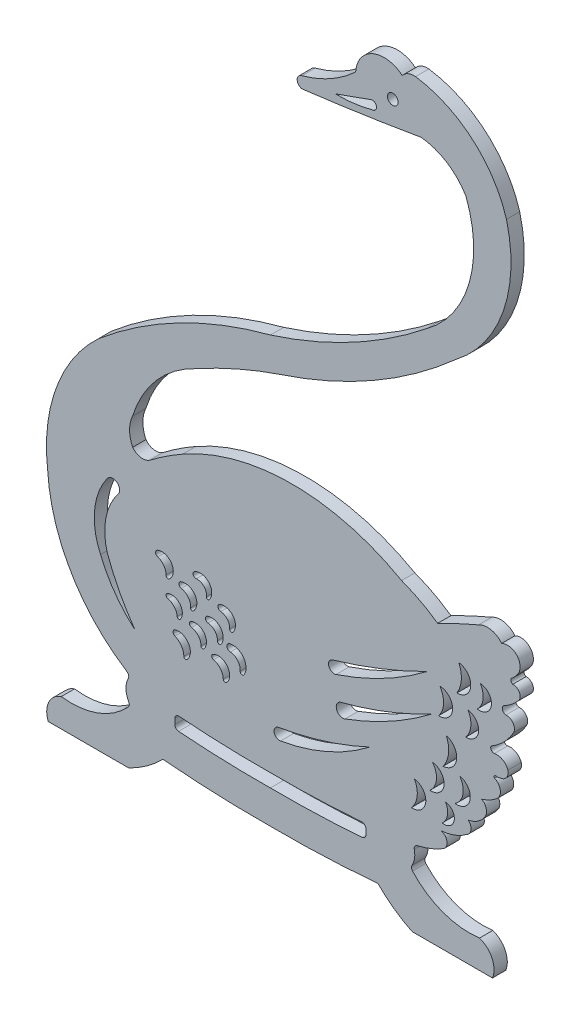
SolidWorks part; units mm, degrees
ref_plane "Спереди" through (0, 0, 0) normal (0, 0, 1) x (1, 0, 0)
ref_plane "Сверху" through (0, 0, 0) normal (0, 1, 0) x (1, 0, 0)
ref_plane "Справа" through (0, 0, 0) normal (1, 0, 0) x (0, 0, -1)
imported_body "Импортированный1"
sketch "Эскиз2" plane through (0, 0, 0) normal (0, 0, -1) x (-1, 0, 0)
  line L3 (868.5282, 469.7115) -> (538.7238, 469.7115)
  line L4 (401.7946, 19.7115) -> (522.9904, 19.7115)
  line L5 (949.7016, 19.7115) -> (1070.8973, 19.7115)
  line L6 (868.5282, 469.7115) -> (538.7238, 469.7115)
  line L7 (401.7946, 19.7115) -> (522.9904, 19.7115)
  line L8 (949.7016, 19.7115) -> (1070.8973, 19.7115)
  arc A57 (688.8469, 1035.9946) -> (688.8469, 1053.0676) centre (687.2707, 1044.5311) ccw
  arc A58 (607.9212, 1098.417) -> (688.8469, 1053.0676) centre (740.9753, 1240.9709) ccw
  arc A59 (607.9212, 1098.417) -> (537.6825, 1129.021) centre (565.0001, 1095.8133) ccw
  arc A60 (537.6825, 1129.021) -> (517.6288, 1137.6043) centre (519.6877, 1114.6966) ccw
  arc A61 (517.6288, 1137.6043) -> (380.7487, 1019.8224) centre (541.7215, 971.1765) ccw
  arc A62 (380.7487, 1019.8224) -> (456.8229, 799.0795) centre (584.4304, 966.5368) ccw
  arc A63 (456.8229, 799.0795) -> (719.8602, 647.7491) centre (951.0519, 1353.8648) ccw
  arc A64 (848.3446, 591.2479) -> (719.8602, 647.7491) centre (462.2939, -112.2987) ccw
  arc A65 (943.7801, 481.9923) -> (848.3446, 591.2479) centre (771.992, 428.244) ccw
  arc A66 (943.7801, 440.9891) -> (943.7801, 481.9923) centre (900.4631, 461.4907) ccw
  arc A67 (918.5018, 436.6678) -> (943.7801, 440.9891) centre (928.7783, 452.6488) ccw
  arc A68 (918.5018, 436.6678) -> (868.5282, 469.7115) centre (652.2659, 88.3366) ccw
  arc A69 (538.7238, 469.7115) -> (484.3368, 441.1015) centre (619.0578, 250.9983) ccw
  arc A70 (484.3368, 441.1015) -> (422.9922, 469.7115) centre (17.8065, -479.148) ccw
  arc A71 (422.9922, 469.7115) -> (388.0052, 462.9934) centre (409.3249, 446.4262) ccw
  arc A72 (388.0052, 462.9934) -> (364.5858, 433.9937) centre (379.1684, 446.1735) ccw
  arc A73 (364.5858, 433.9937) -> (373.3228, 424.8523) centre (396.3844, 455.6397) ccw
  arc A74 (371.3054, 418.0965) -> (373.3228, 424.8523) centre (369.8094, 422.2224) ccw
  arc A75 (371.3054, 418.0965) -> (364.5858, 399.1712) centre (370.4747, 407.7359) ccw
  arc A76 (364.5858, 399.1712) -> (383.6651, 384.2135) centre (413.5253, 441.9488) ccw
  arc A77 (381.5911, 372.8991) -> (383.6651, 384.2135) centre (380.9471, 378.8645) ccw
  arc A78 (381.5911, 372.8991) -> (370.0347, 355.5399) centre (380.757, 360.9281) ccw
  arc A79 (370.0347, 355.5399) -> (403.8072, 321.3501) centre (449.0444, 399.81) ccw
  arc A80 (399.0201, 313.9207) -> (403.8072, 321.3501) centre (399.4473, 318.9024) ccw
  arc A81 (399.0201, 313.9207) -> (378.4043, 302.6039) centre (395.2702, 296.3156) ccw
  arc A82 (378.4043, 302.6039) -> (388.7243, 286.6638) centre (391.0184, 299.4597) ccw
  arc A83 (388.7243, 286.6638) -> (397.4244, 285.8687) centre (395.1293, 308.7539) ccw
  arc A84 (398.5381, 281.9715) -> (397.4244, 285.8687) centre (397.0366, 283.6502) ccw
  arc A85 (398.5381, 281.9715) -> (396.3989, 255.9783) centre (404.8559, 268.3669) ccw
  arc A86 (396.3989, 255.9783) -> (418.0373, 244.8271) centre (437.3612, 308.8941) ccw
  arc A87 (418.0373, 244.8271) -> (412.1859, 225.8588) centre (425.4569, 232.1516) ccw
  arc A88 (412.1859, 225.8588) -> (438.4016, 207.5553) centre (444.3958, 244.0665) ccw
  arc A89 (438.4016, 207.5553) -> (440.6745, 187.5726) centre (446.0444, 198.304) ccw
  arc A90 (440.6745, 187.5726) -> (478.9066, 173.1064) centre (484.745, 246.2905) ccw
  arc A91 (478.9066, 173.1064) -> (476.6802, 150.9026) centre (482.1883, 161.5638) ccw
  arc A92 (476.6802, 150.9026) -> (515.0092, 135.7547) centre (543.7388, 264.5152) ccw
  arc A93 (519.5611, 128.6035) -> (515.0092, 135.7547) centre (513.7025, 129.8987) ccw
  arc A94 (519.5611, 128.6035) -> (523.0272, 105.9882) centre (550.4773, 121.7686) ccw
  arc A95 (522.2621, 98.9584) -> (523.0272, 105.9882) centre (517.8255, 102.9978) ccw
  arc A96 (421.3182, 62.049) -> (522.2621, 98.9584) centre (436.4876, 177.0528) ccw
  arc A97 (421.3182, 62.049) -> (401.7946, 19.7115) centre (431.4641, 31.7) ccw
  arc A98 (522.9904, 19.7115) -> (574.4358, 56.8142) centre (441.129, 187.4353) ccw
  arc A99 (574.4358, 56.8142) -> (736.346, 50.3505) centre (720.9793, 1696.5312) ccw
  arc A100 (736.346, 50.3505) -> (898.2562, 56.8142) centre (751.7127, 1696.5312) ccw
  arc A101 (898.2562, 56.8142) -> (949.7016, 19.7115) centre (1031.563, 187.4353) ccw
  arc A102 (1070.8973, 19.7115) -> (1051.3738, 62.049) centre (1041.2279, 31.7) ccw
  arc A103 (950.4298, 98.9584) -> (1051.3738, 62.049) centre (1036.2044, 177.0528) ccw
  arc A104 (949.6647, 105.9882) -> (950.4298, 98.9584) centre (954.8664, 102.9978) ccw
  arc A105 (949.6647, 105.9882) -> (950.3117, 136.366) centre (922.2147, 121.7686) ccw
  arc A106 (952.4117, 144.1922) -> (950.3117, 136.366) centre (955.636, 139.1322) ccw
  arc A107 (952.4117, 144.1922) -> (1071.7649, 347.0866) centre (813.231, 362.6178) ccw
  arc A108 (1071.7649, 347.0866) -> (995.3907, 556.8052) centre (828.6364, 377.3114) ccw
  arc A109 (995.3907, 556.8052) -> (736.346, 691.1896) centre (568.8211, 51.3974) ccw
  arc A110 (500.679, 817.3958) -> (736.346, 691.1896) centre (958.7548, 1389.6331) ccw
  arc A111 (441.9184, 1019.8224) -> (500.679, 817.3958) centre (603.0521, 956.8545) ccw
  arc A112 (509.1798, 1062.5484) -> (441.9184, 1019.8224) centre (518.2213, 974.0089) ccw
  arc A113 (509.1798, 1062.5484) -> (688.8469, 1035.9946) centre (1152.0143, 4790.9526) ccw
  arc A114 (688.8469, 1035.9946) -> (688.8469, 1053.0676) centre (687.2707, 1044.5311) ccw
  arc A115 (607.9212, 1098.417) -> (688.8469, 1053.0676) centre (740.9753, 1240.9709) ccw
  arc A116 (607.9212, 1098.417) -> (537.6825, 1129.021) centre (565.0001, 1095.8133) ccw
  arc A117 (537.6825, 1129.021) -> (517.6288, 1137.6043) centre (519.6877, 1114.6966) ccw
  arc A118 (517.6288, 1137.6043) -> (380.7487, 1019.8224) centre (541.7215, 971.1765) ccw
  arc A119 (380.7487, 1019.8224) -> (456.8229, 799.0795) centre (584.4304, 966.5368) ccw
  arc A120 (456.8229, 799.0795) -> (719.8602, 647.7491) centre (951.0519, 1353.8648) ccw
  arc A121 (848.3446, 591.2479) -> (719.8602, 647.7491) centre (462.2939, -112.2987) ccw
  arc A122 (943.7801, 481.9923) -> (848.3446, 591.2479) centre (771.992, 428.244) ccw
  arc A123 (943.7801, 440.9891) -> (943.7801, 481.9923) centre (900.4631, 461.4907) ccw
  arc A124 (918.5018, 436.6678) -> (943.7801, 440.9891) centre (928.7783, 452.6488) ccw
  arc A125 (918.5018, 436.6678) -> (868.5282, 469.7115) centre (652.2659, 88.3366) ccw
  arc A126 (538.7238, 469.7115) -> (484.3368, 441.1015) centre (619.0578, 250.9983) ccw
  arc A127 (484.3368, 441.1015) -> (422.9922, 469.7115) centre (17.8065, -479.148) ccw
  arc A128 (422.9922, 469.7115) -> (388.0052, 462.9934) centre (409.3249, 446.4262) ccw
  arc A129 (388.0052, 462.9934) -> (364.5858, 433.9937) centre (379.1684, 446.1735) ccw
  arc A130 (364.5858, 433.9937) -> (373.3228, 424.8523) centre (396.3844, 455.6397) ccw
  arc A131 (371.3054, 418.0965) -> (373.3228, 424.8523) centre (369.8094, 422.2224) ccw
  arc A132 (371.3054, 418.0965) -> (364.5858, 399.1712) centre (370.4747, 407.7359) ccw
  arc A133 (364.5858, 399.1712) -> (383.6651, 384.2135) centre (413.5253, 441.9488) ccw
  arc A134 (381.5911, 372.8991) -> (383.6651, 384.2135) centre (380.9471, 378.8645) ccw
  arc A135 (381.5911, 372.8991) -> (370.0347, 355.5399) centre (380.757, 360.9281) ccw
  arc A136 (370.0347, 355.5399) -> (403.8072, 321.3501) centre (449.0444, 399.81) ccw
  arc A137 (399.0201, 313.9207) -> (403.8072, 321.3501) centre (399.4473, 318.9024) ccw
  arc A138 (399.0201, 313.9207) -> (378.4043, 302.6039) centre (395.2702, 296.3156) ccw
  arc A139 (378.4043, 302.6039) -> (388.7243, 286.6638) centre (391.0184, 299.4597) ccw
  arc A140 (388.7243, 286.6638) -> (397.4244, 285.8687) centre (395.1293, 308.7539) ccw
  arc A141 (398.5381, 281.9715) -> (397.4244, 285.8687) centre (397.0366, 283.6502) ccw
  arc A142 (398.5381, 281.9715) -> (396.3989, 255.9783) centre (404.8559, 268.3669) ccw
  arc A143 (396.3989, 255.9783) -> (418.0373, 244.8271) centre (437.3612, 308.8941) ccw
  arc A144 (418.0373, 244.8271) -> (412.1859, 225.8588) centre (425.4569, 232.1516) ccw
  arc A145 (412.1859, 225.8588) -> (438.4016, 207.5553) centre (444.3958, 244.0665) ccw
  arc A146 (438.4016, 207.5553) -> (440.6745, 187.5726) centre (446.0444, 198.304) ccw
  arc A147 (440.6745, 187.5726) -> (478.9066, 173.1064) centre (484.745, 246.2905) ccw
  arc A148 (478.9066, 173.1064) -> (476.6802, 150.9026) centre (482.1883, 161.5638) ccw
  arc A149 (476.6802, 150.9026) -> (515.0092, 135.7547) centre (543.7388, 264.5152) ccw
  arc A150 (519.5611, 128.6035) -> (515.0092, 135.7547) centre (513.7025, 129.8987) ccw
  arc A151 (519.5611, 128.6035) -> (523.0272, 105.9882) centre (550.4773, 121.7686) ccw
  arc A152 (522.2621, 98.9584) -> (523.0272, 105.9882) centre (517.8255, 102.9978) ccw
  arc A153 (421.3182, 62.049) -> (522.2621, 98.9584) centre (436.4876, 177.0528) ccw
  arc A154 (421.3182, 62.049) -> (401.7946, 19.7115) centre (431.4641, 31.7) ccw
  arc A155 (522.9904, 19.7115) -> (574.4358, 56.8142) centre (441.129, 187.4353) ccw
  arc A156 (574.4358, 56.8142) -> (736.346, 50.3505) centre (720.9793, 1696.5312) ccw
  arc A157 (736.346, 50.3505) -> (898.2562, 56.8142) centre (751.7127, 1696.5312) ccw
  arc A158 (898.2562, 56.8142) -> (949.7016, 19.7115) centre (1031.563, 187.4353) ccw
  arc A159 (1070.8973, 19.7115) -> (1051.3738, 62.049) centre (1041.2279, 31.7) ccw
  arc A160 (950.4298, 98.9584) -> (1051.3738, 62.049) centre (1036.2044, 177.0528) ccw
  arc A161 (949.6647, 105.9882) -> (950.4298, 98.9584) centre (954.8664, 102.9978) ccw
  arc A162 (949.6647, 105.9882) -> (950.3117, 136.366) centre (922.2147, 121.7686) ccw
  arc A163 (952.4117, 144.1922) -> (950.3117, 136.366) centre (955.636, 139.1322) ccw
  arc A164 (952.4117, 144.1922) -> (1071.7649, 347.0866) centre (813.231, 362.6178) ccw
  arc A165 (1071.7649, 347.0866) -> (995.3907, 556.8052) centre (828.6364, 377.3114) ccw
  arc A166 (995.3907, 556.8052) -> (736.346, 691.1896) centre (568.8211, 51.3974) ccw
  arc A167 (500.679, 817.3958) -> (736.346, 691.1896) centre (958.7548, 1389.6331) ccw
  arc A168 (441.9184, 1019.8224) -> (500.679, 817.3958) centre (603.0521, 956.8545) ccw
  arc A169 (509.1798, 1062.5484) -> (441.9184, 1019.8224) centre (518.2213, 974.0089) ccw
  arc A170 (509.1798, 1062.5484) -> (688.8469, 1035.9946) centre (1152.0143, 4790.9526) ccw
  dimension "D1" = 0
extrude "Бобышка-Вытянуть1" add sketch "Эскиз2" along normal blind 10
sketch "Эскиз3" plane through (0, 0, 0) normal (0, 0, 1) x (1, 0, 0)
  line L2 (-592.4581, 111.0344) -> (-592.4581, 119.0272)
  line L3 (-880.2338, 119.0272) -> (-880.2338, 111.0344)
  line L4 (-592.4581, 111.0344) -> (-592.4581, 119.0272)
  line L5 (-880.2338, 119.0272) -> (-880.2338, 111.0344)
  arc A0 (-477.5905, 184.1168) -> (-472.5039, 214.1392) centre (-474.4703, 199.0303) ccw construction
  arc A1 (-477.5905, 184.1168) -> (-472.5039, 214.1392) centre (-492.9762, 202.1657) ccw construction
  arc A2 (-458.1955, 219.2578) -> (-451.2096, 258.6271) centre (-455.2554, 239.0406) ccw construction
  arc A3 (-458.1955, 219.2578) -> (-451.2096, 258.6271) centre (-473.3308, 242.2479) ccw construction
  arc A4 (-496.0892, 217.5153) -> (-492.1133, 255.9783) centre (-494.0507, 236.7416) ccw construction
  arc A5 (-496.0892, 217.5153) -> (-492.1133, 255.9783) centre (-513.6282, 238.7653) ccw construction
  arc A6 (-523.9435, 180.8733) -> (-519.3103, 220.586) centre (-522.222, 200.799) ccw construction
  arc A7 (-523.9435, 180.8733) -> (-519.3103, 220.586) centre (-549.3516, 203.9642) ccw construction
  arc A8 (-597.9941, 105.0524) -> (-592.4581, 111.0344) centre (-598.4581, 111.0344) ccw
  arc A9 (-592.4581, 119.0272) -> (-598.9252, 125.009) centre (-598.4581, 119.0272) ccw
  arc A10 (-736.346, 120.2942) -> (-598.9252, 125.009) centre (-721.6327, 1696.4778) ccw
  arc A11 (-873.7668, 125.009) -> (-736.346, 120.2942) centre (-751.0593, 1696.4778) ccw
  arc A12 (-873.7668, 125.009) -> (-880.2338, 119.0272) centre (-874.2338, 119.0272) ccw
  arc A13 (-880.2338, 111.0344) -> (-874.6979, 105.0524) centre (-874.2338, 111.0344) ccw
  arc A14 (-874.6979, 105.0524) -> (-736.346, 100.341) centre (-751.246, 1696.5238) ccw
  arc A15 (-736.346, 100.341) -> (-597.9941, 105.0524) centre (-721.446, 1696.5238) ccw
  arc A16 (-597.9941, 105.0524) -> (-592.4581, 111.0344) centre (-598.4581, 111.0344) ccw
  arc A17 (-592.4581, 119.0272) -> (-598.9252, 125.009) centre (-598.4581, 119.0272) ccw
  arc A18 (-736.346, 120.2942) -> (-598.9252, 125.009) centre (-721.6327, 1696.4778) ccw
  arc A19 (-873.7668, 125.009) -> (-736.346, 120.2942) centre (-751.0593, 1696.4778) ccw
  arc A20 (-873.7668, 125.009) -> (-880.2338, 119.0272) centre (-874.2338, 119.0272) ccw
  arc A21 (-880.2338, 111.0344) -> (-874.6979, 105.0524) centre (-874.2338, 111.0344) ccw
  arc A22 (-874.6979, 105.0524) -> (-736.346, 100.341) centre (-751.246, 1696.5238) ccw
  arc A23 (-736.346, 100.341) -> (-597.9941, 105.0524) centre (-721.446, 1696.5238) ccw
  arc A24 (-476.3308, 258.6271) -> (-471.4266, 301.351) centre (-477.5097, 280.4058) ccw construction
  arc A25 (-476.3308, 258.6271) -> (-471.4266, 301.351) centre (-509.5697, 284.0859) ccw construction
  arc A26 (-441.8768, 313.9207) -> (-438.378, 350.7936) centre (-441.1818, 332.4572) ccw construction
  arc A27 (-441.8768, 313.9207) -> (-438.378, 350.7936) centre (-467.1669, 334.9228) ccw construction
  arc A28 (-424.6824, 359.1917) -> (-420.1448, 394.8384) centre (-421.336, 376.8779) ccw construction
  arc A29 (-424.6824, 359.1917) -> (-420.1448, 394.8384) centre (-444.1827, 379.7861) ccw construction
  arc A30 (-455.3824, 364.6592) -> (-452.3767, 405.8028) centre (-455.1888, 385.3266) ccw construction
  arc A31 (-455.3824, 364.6592) -> (-452.3767, 405.8028) centre (-492.5757, 388.0578) ccw construction
  arc A32 (-482.9082, 321.3501) -> (-481.1588, 360.9281) centre (-481.6856, 341.1237) ccw construction
  arc A33 (-482.9082, 321.3501) -> (-481.1588, 360.9281) centre (-508.4558, 342.307) ccw construction
  arc A34 (-623.9132, 246.5173) -> (-492.6473, 318.6729) centre (-797.3924, 717.5895) ccw construction
  arc A35 (-630.3339, 265.0895) -> (-492.6473, 318.6729) centre (-790.1828, 879.5234) ccw construction
  arc A36 (-630.3339, 265.0895) -> (-623.9132, 246.5173) centre (-627.3093, 255.7392) ccw construction
  arc A37 (-637.432, 297.8044) -> (-500.0717, 370.3439) centre (-787.5815, 748.4485) ccw construction
  arc A38 (-643.2502, 314.0066) -> (-500.0717, 370.3439) centre (-880.1458, 1126.1742) ccw construction
  arc A39 (-643.2502, 314.0066) -> (-637.432, 297.8044) centre (-640.1536, 305.9729) ccw construction
  arc A40 (-721.0746, 169.224) -> (-586.6425, 228.5446) centre (-773.7805, 470.6507) ccw construction
  arc A41 (-724.5954, 185.3932) -> (-586.6425, 228.5446) centre (-815.3819, 717.7235) ccw construction
  arc A42 (-724.5954, 185.3932) -> (-721.0746, 169.224) centre (-722.501, 177.3813) ccw construction
  arc A43 (-776.1585, 227.8902) -> (-797.7578, 257.8293) centre (-792.8378, 238.6179) ccw construction
  arc A44 (-797.7578, 257.8293) -> (-796.7761, 247.4894) centre (-796.4536, 252.7366) ccw construction
  arc A45 (-781.8418, 229.8817) -> (-796.7761, 247.4894) centre (-797.7578, 231.5196) ccw construction
  arc A46 (-781.8418, 229.8817) -> (-776.1585, 227.8902) centre (-778.7622, 229.5649) ccw construction
  arc A47 (-802.3544, 204.8909) -> (-822.8115, 231.5196) centre (-814.697, 216.5812) ccw construction
  arc A48 (-822.8115, 231.5196) -> (-821.9153, 224.7626) centre (-821.0695, 228.3127) ccw construction
  arc A49 (-807.3255, 206.7939) -> (-821.9153, 224.7626) centre (-826.3186, 206.2799) ccw construction
  arc A50 (-807.3255, 206.7939) -> (-802.3544, 204.8909) centre (-804.4459, 206.8719) ccw construction
  arc A51 (-836.5946, 231.5196) -> (-856.0766, 257.8293) centre (-849.4021, 242.4038) ccw construction
  arc A52 (-856.0766, 257.8293) -> (-855.1364, 250.3431) centre (-854.5162, 254.2231) ccw construction
  arc A53 (-840.8251, 233.1342) -> (-855.1364, 250.3431) centre (-857.8199, 233.5562) ccw construction
  arc A54 (-840.8251, 233.1342) -> (-836.5946, 231.5196) centre (-838.4245, 233.0746) ccw construction
  arc A55 (-810.7489, 250.554) -> (-831.5754, 276.7456) centre (-824.8011, 260.7562) ccw construction
  arc A56 (-831.5754, 276.7456) -> (-830.2692, 268.551) centre (-829.908, 272.8099) ccw construction
  arc A57 (-816.1316, 252.4391) -> (-830.2692, 268.551) centre (-831.5754, 253.1462) ccw construction
  arc A58 (-816.1316, 252.4391) -> (-810.7489, 250.554) centre (-813.1578, 252.3029) ccw construction
  arc A59 (-792.8139, 275.2398) -> (-812.5219, 301.6969) centre (-805.9651, 286.0122) ccw construction
  arc A60 (-812.5219, 301.6969) -> (-811.1852, 293.0494) centre (-810.7836, 297.5385) ccw construction
  arc A61 (-797.555, 277.1135) -> (-811.1852, 293.0494) centre (-812.5219, 278.1091) ccw construction
  arc A62 (-797.555, 277.1135) -> (-792.8139, 275.2398) centre (-794.8844, 276.9358) ccw construction
  arc A63 (-872.1065, 252.4479) -> (-891.2805, 276.7456) centre (-884.982, 262.0017) ccw construction
  arc A64 (-891.2805, 276.7456) -> (-890.6768, 269.9925) centre (-889.88, 273.4673) ccw construction
  arc A65 (-876.7501, 253.7923) -> (-890.6768, 269.9925) centre (-894.6999, 252.4479) ccw construction
  arc A66 (-876.7501, 253.7923) -> (-872.1065, 252.4479) centre (-874.1779, 253.9849) ccw construction
  arc A67 (-852.5926, 273.0351) -> (-871.677, 301.6969) centre (-864.528, 285.7725) ccw construction
  arc A68 (-871.677, 301.6969) -> (-870.6321, 293.5056) centre (-869.9096, 297.7601) ccw construction
  arc A69 (-856.5673, 275.0054) -> (-870.6321, 293.5056) centre (-873.478, 276.7456) ccw construction
  arc A70 (-856.5673, 275.0054) -> (-852.5926, 273.0351) centre (-854.2118, 274.763) ccw construction
  arc A71 (-828.6405, 299.7337) -> (-850.6405, 325.4198) centre (-841.7978, 310.7291) ccw construction
  arc A72 (-850.6405, 325.4198) -> (-847.9704, 317.4421) centre (-848.4183, 321.7279) ccw construction
  arc A73 (-832.6577, 301.5251) -> (-847.9704, 317.4421) centre (-846.5152, 303.5179) ccw construction
  arc A74 (-832.6577, 301.5251) -> (-828.6405, 299.7337) centre (-830.3948, 301.1997) ccw construction
  arc A75 (-888.4071, 297.053) -> (-906.4358, 325.4198) centre (-899.5852, 309.8612) ccw construction
  arc A76 (-906.4358, 325.4198) -> (-905.9846, 316.8801) centre (-904.5934, 321.2354) ccw construction
  arc A77 (-893.4647, 299.4075) -> (-905.9846, 316.8801) centre (-911.4617, 299.7337) ccw construction
  arc A78 (-893.4647, 299.4075) -> (-888.4071, 297.053) centre (-890.4136, 299.3522) ccw construction
  arc A79 (-862.2123, 204.8505) -> (-879.3725, 235.078) centre (-874.8672, 217.6509) ccw construction
  arc A80 (-879.3725, 235.078) -> (-879.9772, 226.5037) centre (-878.238, 230.6895) ccw construction
  arc A81 (-866.6981, 206.7108) -> (-879.9772, 226.5037) centre (-888.2448, 206.606) ccw construction
  arc A82 (-866.6981, 206.7108) -> (-862.2123, 204.8505) centre (-864.0641, 206.7236) ccw construction
  arc A83 (-992.1136, 276.882) -> (-940.1502, 204.4855) centre (-816.9171, 347.7845) ccw construction
  arc A84 (-982.0148, 284.2433) -> (-940.1502, 204.4855) centre (-668.2313, 398.0808) ccw construction
  arc A85 (-965.6462, 368.9995) -> (-982.0148, 284.2433) centre (-891.8403, 310.7871) ccw construction
  arc A86 (-965.6462, 368.9995) -> (-981.9263, 381.2954) centre (-973.6574, 375.3181) ccw construction
  arc A87 (-981.9263, 381.2954) -> (-992.1136, 276.882) centre (-897.6418, 320.3684) ccw construction
  arc A88 (-638.7661, 1054.6399) -> (-580.3301, 1062.23) centre (-635.527, 1258.4469) ccw construction
  arc A89 (-580.3301, 1062.23) -> (-584.8507, 1073.9657) centre (-582.6845, 1068.0616) ccw construction
  arc A90 (-638.7661, 1054.6399) -> (-584.8507, 1073.9657) centre (-1907.4817, 4678.9966) ccw construction
  circle A91 centre (-551.972, 1090.8568) radius 8 construction
  arc A92 (-477.5905, 184.1168) -> (-472.5039, 214.1392) centre (-474.4703, 199.0303) ccw
  arc A93 (-477.5905, 184.1168) -> (-472.5039, 214.1392) centre (-492.9762, 202.1657) ccw
  arc A94 (-458.1955, 219.2578) -> (-451.2096, 258.6271) centre (-455.2554, 239.0406) ccw
  arc A95 (-458.1955, 219.2578) -> (-451.2096, 258.6271) centre (-473.3308, 242.2479) ccw
  arc A96 (-496.0892, 217.5153) -> (-492.1133, 255.9783) centre (-494.0507, 236.7416) ccw
  arc A97 (-496.0892, 217.5153) -> (-492.1133, 255.9783) centre (-513.6282, 238.7653) ccw
  arc A98 (-523.9435, 180.8733) -> (-519.3103, 220.586) centre (-522.222, 200.799) ccw
  arc A99 (-523.9435, 180.8733) -> (-519.3103, 220.586) centre (-549.3516, 203.9642) ccw
  arc A100 (-476.3308, 258.6271) -> (-471.4266, 301.351) centre (-477.5097, 280.4058) ccw
  arc A101 (-476.3308, 258.6271) -> (-471.4266, 301.351) centre (-509.5697, 284.0859) ccw
  arc A102 (-441.8768, 313.9207) -> (-438.378, 350.7936) centre (-441.1818, 332.4572) ccw
  arc A103 (-441.8768, 313.9207) -> (-438.378, 350.7936) centre (-467.1669, 334.9228) ccw
  arc A104 (-424.6824, 359.1917) -> (-420.1448, 394.8384) centre (-421.336, 376.8779) ccw
  arc A105 (-424.6824, 359.1917) -> (-420.1448, 394.8384) centre (-444.1827, 379.7861) ccw
  arc A106 (-455.3824, 364.6592) -> (-452.3767, 405.8028) centre (-455.1888, 385.3266) ccw
  arc A107 (-455.3824, 364.6592) -> (-452.3767, 405.8028) centre (-492.5757, 388.0578) ccw
  arc A108 (-482.9082, 321.3501) -> (-481.1588, 360.9281) centre (-481.6856, 341.1237) ccw
  arc A109 (-482.9082, 321.3501) -> (-481.1588, 360.9281) centre (-508.4558, 342.307) ccw
  arc A110 (-623.9132, 246.5173) -> (-492.6473, 318.6729) centre (-797.3924, 717.5895) ccw
  arc A111 (-630.3339, 265.0895) -> (-492.6473, 318.6729) centre (-790.1828, 879.5234) ccw
  arc A112 (-630.3339, 265.0895) -> (-623.9132, 246.5173) centre (-627.3093, 255.7392) ccw
  arc A113 (-637.432, 297.8044) -> (-500.0717, 370.3439) centre (-787.5815, 748.4485) ccw
  arc A114 (-643.2502, 314.0066) -> (-500.0717, 370.3439) centre (-880.1458, 1126.1742) ccw
  arc A115 (-643.2502, 314.0066) -> (-637.432, 297.8044) centre (-640.1536, 305.9729) ccw
  arc A116 (-721.0746, 169.224) -> (-586.6425, 228.5446) centre (-773.7805, 470.6507) ccw
  arc A117 (-724.5954, 185.3932) -> (-586.6425, 228.5446) centre (-815.3819, 717.7235) ccw
  arc A118 (-724.5954, 185.3932) -> (-721.0746, 169.224) centre (-722.501, 177.3813) ccw
  arc A119 (-776.1585, 227.8902) -> (-797.7578, 257.8293) centre (-792.8378, 238.6179) ccw
  arc A120 (-797.7578, 257.8293) -> (-796.7761, 247.4894) centre (-796.4536, 252.7366) ccw
  arc A121 (-781.8418, 229.8817) -> (-796.7761, 247.4894) centre (-797.7578, 231.5196) ccw
  arc A122 (-781.8418, 229.8817) -> (-776.1585, 227.8902) centre (-778.7622, 229.5649) ccw
  arc A123 (-802.3544, 204.8909) -> (-822.8115, 231.5196) centre (-814.697, 216.5812) ccw
  arc A124 (-822.8115, 231.5196) -> (-821.9153, 224.7626) centre (-821.0695, 228.3127) ccw
  arc A125 (-807.3255, 206.7939) -> (-821.9153, 224.7626) centre (-826.3186, 206.2799) ccw
  arc A126 (-807.3255, 206.7939) -> (-802.3544, 204.8909) centre (-804.4459, 206.8719) ccw
  arc A127 (-836.5946, 231.5196) -> (-856.0766, 257.8293) centre (-849.4021, 242.4038) ccw
  arc A128 (-856.0766, 257.8293) -> (-855.1364, 250.3431) centre (-854.5162, 254.2231) ccw
  arc A129 (-840.8251, 233.1342) -> (-855.1364, 250.3431) centre (-857.8199, 233.5562) ccw
  arc A130 (-840.8251, 233.1342) -> (-836.5946, 231.5196) centre (-838.4245, 233.0746) ccw
  arc A131 (-810.7489, 250.554) -> (-831.5754, 276.7456) centre (-824.8011, 260.7562) ccw
  arc A132 (-831.5754, 276.7456) -> (-830.2692, 268.551) centre (-829.908, 272.8099) ccw
  arc A133 (-816.1316, 252.4391) -> (-830.2692, 268.551) centre (-831.5754, 253.1462) ccw
  arc A134 (-816.1316, 252.4391) -> (-810.7489, 250.554) centre (-813.1578, 252.3029) ccw
  arc A135 (-792.8139, 275.2398) -> (-812.5219, 301.6969) centre (-805.9651, 286.0122) ccw
  arc A136 (-812.5219, 301.6969) -> (-811.1852, 293.0494) centre (-810.7836, 297.5385) ccw
  arc A137 (-797.555, 277.1135) -> (-811.1852, 293.0494) centre (-812.5219, 278.1091) ccw
  arc A138 (-797.555, 277.1135) -> (-792.8139, 275.2398) centre (-794.8844, 276.9358) ccw
  arc A139 (-872.1065, 252.4479) -> (-891.2805, 276.7456) centre (-884.982, 262.0017) ccw
  arc A140 (-891.2805, 276.7456) -> (-890.6768, 269.9925) centre (-889.88, 273.4673) ccw
  arc A141 (-876.7501, 253.7923) -> (-890.6768, 269.9925) centre (-894.6999, 252.4479) ccw
  arc A142 (-876.7501, 253.7923) -> (-872.1065, 252.4479) centre (-874.1779, 253.9849) ccw
  arc A143 (-852.5926, 273.0351) -> (-871.677, 301.6969) centre (-864.528, 285.7725) ccw
  arc A144 (-871.677, 301.6969) -> (-870.6321, 293.5056) centre (-869.9096, 297.7601) ccw
  arc A145 (-856.5673, 275.0054) -> (-870.6321, 293.5056) centre (-873.478, 276.7456) ccw
  arc A146 (-856.5673, 275.0054) -> (-852.5926, 273.0351) centre (-854.2118, 274.763) ccw
  arc A147 (-828.6405, 299.7337) -> (-850.6405, 325.4198) centre (-841.7978, 310.7291) ccw
  arc A148 (-850.6405, 325.4198) -> (-847.9704, 317.4421) centre (-848.4183, 321.7279) ccw
  arc A149 (-832.6577, 301.5251) -> (-847.9704, 317.4421) centre (-846.5152, 303.5179) ccw
  arc A150 (-832.6577, 301.5251) -> (-828.6405, 299.7337) centre (-830.3948, 301.1997) ccw
  arc A151 (-888.4071, 297.053) -> (-906.4358, 325.4198) centre (-899.5852, 309.8612) ccw
  arc A152 (-906.4358, 325.4198) -> (-905.9846, 316.8801) centre (-904.5934, 321.2354) ccw
  arc A153 (-893.4647, 299.4075) -> (-905.9846, 316.8801) centre (-911.4617, 299.7337) ccw
  arc A154 (-893.4647, 299.4075) -> (-888.4071, 297.053) centre (-890.4136, 299.3522) ccw
  arc A155 (-862.2123, 204.8505) -> (-879.3725, 235.078) centre (-874.8672, 217.6509) ccw
  arc A156 (-879.3725, 235.078) -> (-879.9772, 226.5037) centre (-878.238, 230.6895) ccw
  arc A157 (-866.6981, 206.7108) -> (-879.9772, 226.5037) centre (-888.2448, 206.606) ccw
  arc A158 (-866.6981, 206.7108) -> (-862.2123, 204.8505) centre (-864.0641, 206.7236) ccw
  arc A159 (-992.1136, 276.882) -> (-940.1502, 204.4855) centre (-816.9171, 347.7845) ccw
  arc A160 (-982.0148, 284.2433) -> (-940.1502, 204.4855) centre (-668.2313, 398.0808) ccw
  arc A161 (-965.6462, 368.9995) -> (-982.0148, 284.2433) centre (-891.8403, 310.7871) ccw
  arc A162 (-965.6462, 368.9995) -> (-981.9263, 381.2954) centre (-973.6574, 375.3181) ccw
  arc A163 (-981.9263, 381.2954) -> (-992.1136, 276.882) centre (-897.6418, 320.3684) ccw
  arc A164 (-638.7661, 1054.6399) -> (-580.3301, 1062.23) centre (-635.527, 1258.4469) ccw
  arc A165 (-580.3301, 1062.23) -> (-584.8507, 1073.9657) centre (-582.6845, 1068.0616) ccw
  arc A166 (-638.7661, 1054.6399) -> (-584.8507, 1073.9657) centre (-1907.4817, 4678.9966) ccw
  circle A167 centre (-551.972, 1090.8568) radius 8
  dimension "D1" = 0
extrude "Вырез-Вытянуть1" cut sketch "Эскиз3" against normal blind 10
sketch "Эскиз4" plane through (0, 0, 10) normal (0, 0, 1) x (1, 0, 0)
  line L0 (-868.5282, 469.7115) -> (-538.7238, 469.7115)
  arc A0 (-868.5282, 469.7115) -> (-538.7238, 469.7115) centre (-703.626, 178.9093) cw
  arc A1 (-868.5282, 469.7115) -> (-918.5018, 436.6678) centre (-652.2659, 88.3366) ccw construction
extrude "Бобышка-Вытянуть2" add sketch "Эскиз4" against normal up to surface (20 mm away)
